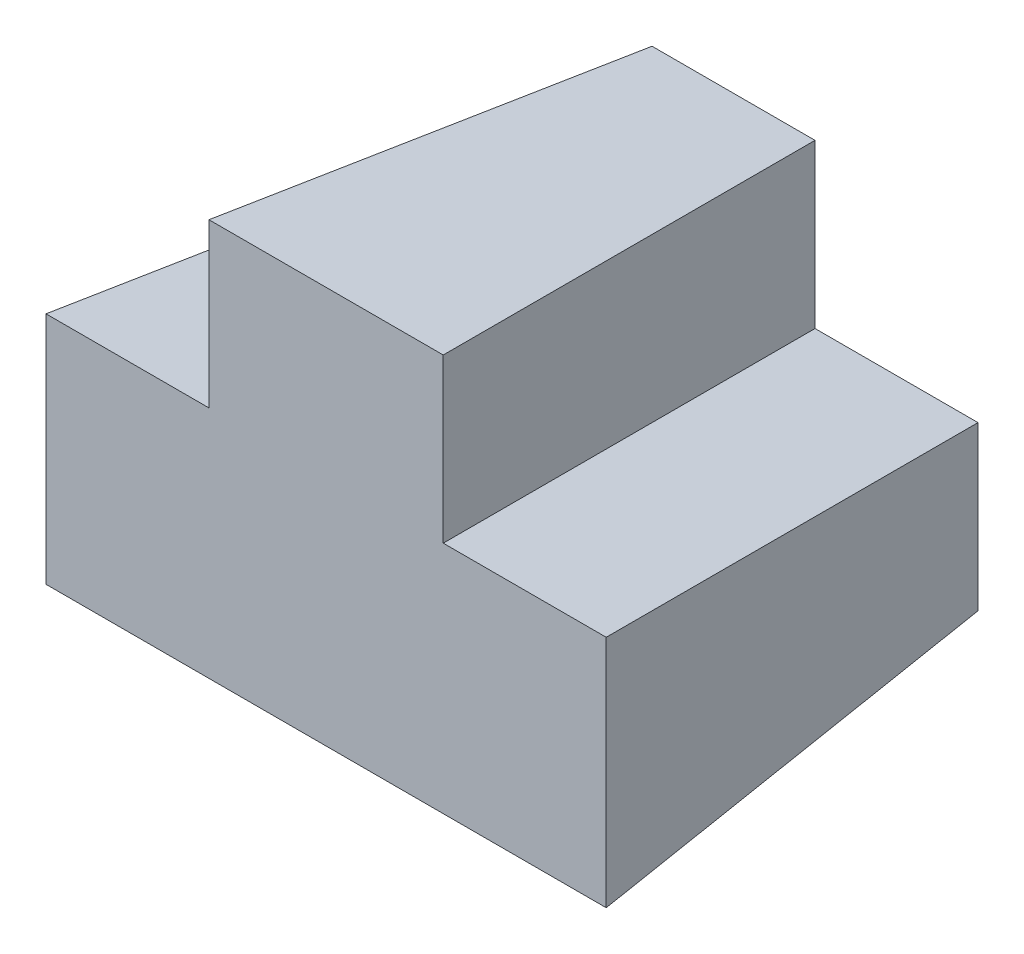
SolidWorks part; units mm, degrees
ref_plane "Front Plane" through (0, 0, 0) normal (0, 0, 1) x (1, 0, 0)
ref_plane "Top Plane" through (0, 0, 0) normal (0, 1, 0) x (1, 0, 0)
ref_plane "Right Plane" through (0, 0, 0) normal (1, 0, 0) x (0, 0, -1)
sketch "Sketch1" plane through (0, 0, 0) normal (0, 0, 1) x (1, 0, 0)
  line L0 (12, 0) -> (-12, 0)
  line L1 (-12, 0) -> (-12, 8)
  line L2 (-12, 8) -> (-4, 8)
  line L3 (-4, 8) -> (-4, 16)
  line L4 (-4, 16) -> (4, 16)
  line L5 (4, 16) -> (4, 8)
  line L6 (4, 8) -> (12, 8)
  line L7 (12, 8) -> (12, 0)
  point P4 (0, 0)
  dimension "D1" = 8
  dimension "D2" = 16
  dimension "D3" = 24
  dimension "D4" = 8
  dimension "D5" = 8
extrude "Boss-Extrude1" add sketch "Sketch1" along normal blind 20 draft 5
